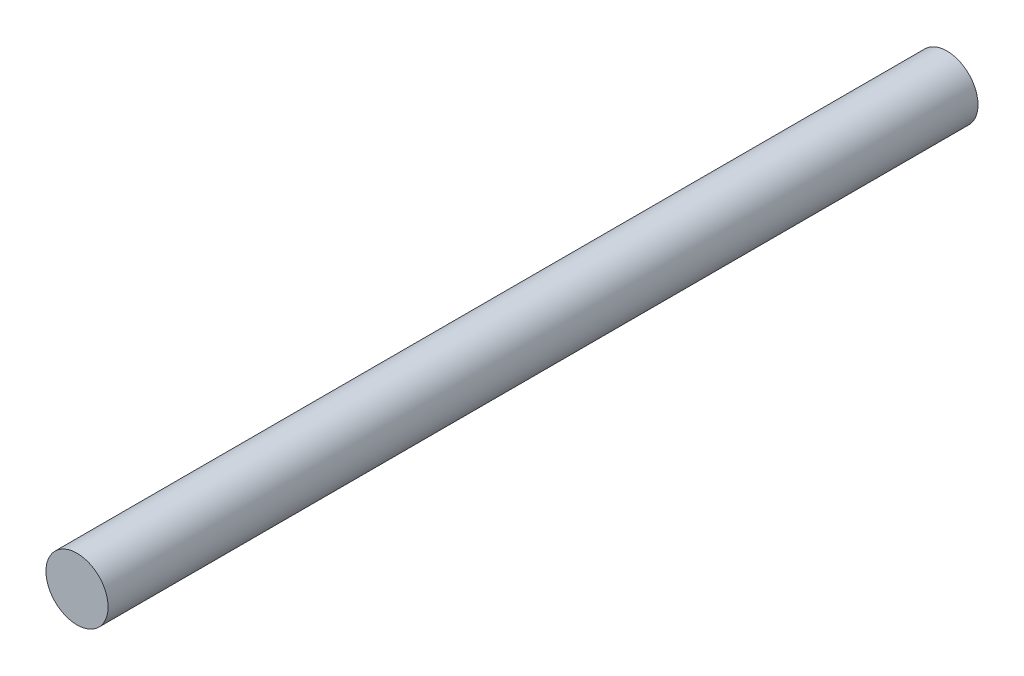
SolidWorks part; units mm, degrees
ref_plane "Front Plane" through (0, 0, 0) normal (0, 0, 1) x (1, 0, 0)
ref_plane "Top Plane" through (0, 0, 0) normal (0, 1, 0) x (1, 0, 0)
ref_plane "Right Plane" through (0, 0, 0) normal (1, 0, 0) x (0, 0, -1)
sketch "Sketch1" plane through (0, 0, 0) normal (0, 0, 1) x (1, 0, 0)
  circle A0 centre (0, 0) radius 5.715
  dimension "D1" = 11.43
extrude "Boss-Extrude1" add sketch "Sketch1" along normal mid plane 160
